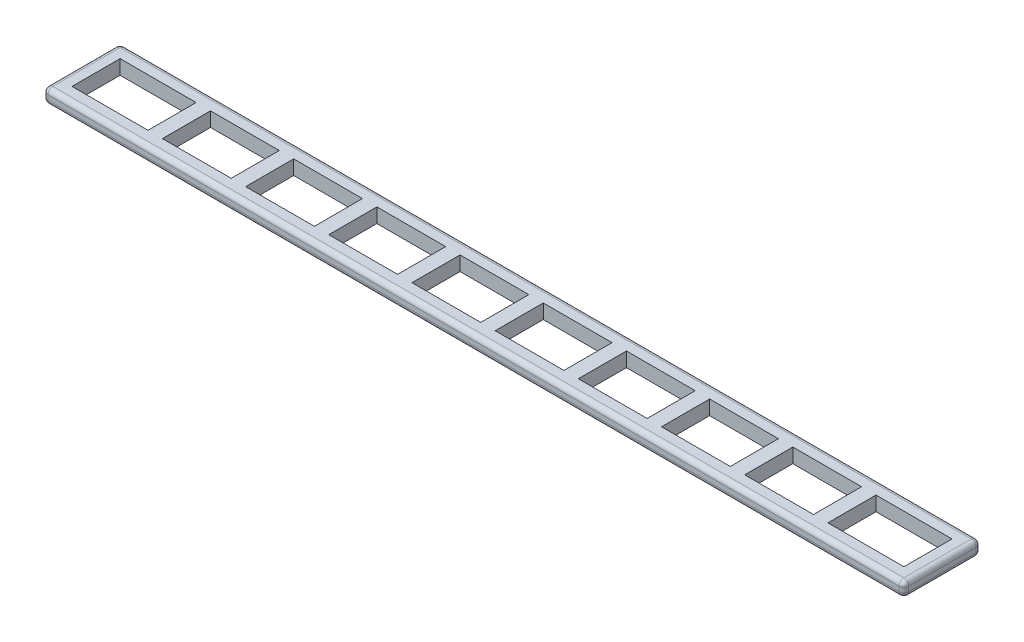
SolidWorks part; units mm, degrees
ref_plane "Front Plane" through (0, 0, 0) normal (0, 0, 1) x (1, 0, 0)
ref_plane "Top Plane" through (0, 0, 0) normal (0, 1, 0) x (1, 0, 0)
ref_plane "Right Plane" through (0, 0, 0) normal (1, 0, 0) x (0, 0, -1)
sketch "Sketch1" plane through (0, 0, 0) normal (1, 0, 0) x (0, 0, -1)
  line L1 (0, 0) -> (25.4, 0)
  line L2 (0, 0) -> (0, 4.7625)
  line L3 (0, 4.7625) -> (25.4, 4.7625)
  line L4 (25.4, 0) -> (25.4, 4.7625)
  dimension "D1" = 4.7625
  dimension "D2" = 25.4
extrude "Boss-Extrude1" add sketch "Sketch1" along normal blind 284.1625
sketch "Sketch2" plane through (0, 4.7625, 0) normal (0, 1, 0) x (1, 0, 0)
  line L14 (279.4, 4.7625) -> (279.4, 20.6375)
  line L15 (4.7625, 4.7625) -> (279.4, 4.7625)
  line L16 (279.4, 20.6375) -> (4.7625, 20.6375)
  line L17 (4.7625, 20.6375) -> (4.7625, 4.7625)
  line L18 (279.4, 4.7625) -> (279.4, 20.6375)
  line L19 (4.7625, 4.7625) -> (279.4, 4.7625)
  line L20 (279.4, 20.6375) -> (4.7625, 20.6375)
  line L21 (4.7625, 20.6375) -> (4.7625, 4.7625)
  dimension "D1" = 4.7625
extrude "Cut-Extrude1" cut sketch "Sketch2" against normal through all both and the other way through all
sketch "Sketch4" plane through (0, 0, -20.6375) normal (0, 0, 1) x (1, 0, 0)
  line L0 (4.7625, 4.7625) -> (279.4, 4.7625) construction
  line L1 (29.845, 4.7625) -> (34.6075, 4.7625)
  line L2 (29.845, 4.7625) -> (29.845, 0)
  line L3 (29.845, 0) -> (34.6075, 0)
  line L4 (34.6075, 4.7625) -> (34.6075, 0)
  line L5 (279.4, 0) -> (4.7625, 0) construction
  line L6 (32.2263, 4.7625) -> (32.2263, 0) construction
  line L7 (4.7625, 0) -> (4.7625, 4.7625) construction
  line L8 (57.3088, 4.7625) -> (57.3088, 0)
  line L9 (57.3088, 0) -> (62.0713, 0)
  line L10 (62.0713, 4.7625) -> (62.0713, 0)
  line L11 (57.3088, 4.7625) -> (62.0713, 4.7625)
  line L12 (84.7725, 4.7625) -> (84.7725, 0)
  line L13 (84.7725, 0) -> (89.535, 0)
  line L14 (89.535, 4.7625) -> (89.535, 0)
  line L15 (84.7725, 4.7625) -> (89.535, 4.7625)
  line L16 (112.2363, 4.7625) -> (112.2363, 0)
  line L17 (112.2363, 0) -> (116.9988, 0)
  line L18 (116.9988, 4.7625) -> (116.9988, 0)
  line L19 (112.2363, 4.7625) -> (116.9988, 4.7625)
  line L20 (139.7, 4.7625) -> (139.7, 0)
  line L21 (139.7, 0) -> (144.4625, 0)
  line L22 (144.4625, 4.7625) -> (144.4625, 0)
  line L23 (139.7, 4.7625) -> (144.4625, 4.7625)
  line L24 (167.1638, 4.7625) -> (167.1638, 0)
  line L25 (167.1638, 0) -> (171.9263, 0)
  line L26 (171.9263, 4.7625) -> (171.9263, 0)
  line L27 (167.1638, 4.7625) -> (171.9263, 4.7625)
  line L28 (194.6275, 4.7625) -> (194.6275, 0)
  line L29 (194.6275, 0) -> (199.39, 0)
  line L30 (199.39, 4.7625) -> (199.39, 0)
  line L31 (194.6275, 4.7625) -> (199.39, 4.7625)
  line L32 (222.0913, 4.7625) -> (222.0913, 0)
  line L33 (222.0913, 0) -> (226.8538, 0)
  line L34 (226.8538, 4.7625) -> (226.8538, 0)
  line L35 (222.0913, 4.7625) -> (226.8538, 4.7625)
  line L36 (249.555, 4.7625) -> (249.555, 0)
  line L37 (249.555, 0) -> (254.3175, 0)
  line L38 (254.3175, 4.7625) -> (254.3175, 0)
  line L39 (249.555, 4.7625) -> (254.3175, 4.7625)
  line L40 (29.845, 4.7625) -> (57.3088, 4.7625) construction
  point P12 (4.7625, 2.3812)
  dimension "D1" = 4.7625
  dimension "D2" = 27.4638
  dimension "D4" = 27.4638
  dimension "D3" = 9
extrude "Boss-Extrude2" add sketch "Sketch4" along normal up to surface (15.875 mm away)
fillet "Fillet1" radius 1.5875 12 edges at (0, 2.3813, 0) (0, 2.3813, -25.4) (0, 0, -12.7) (0, 4.7625, -12.7) (142.0812, 0, -25.4) (142.0812, 4.7625, -25.4) (284.1625, 0, -12.7) (284.1625, 4.7625, -12.7) (284.1625, 2.3813, -25.4) (284.1625, 2.3813, 0) (142.0812, 0, 0) (142.0812, 4.7625, 0)
